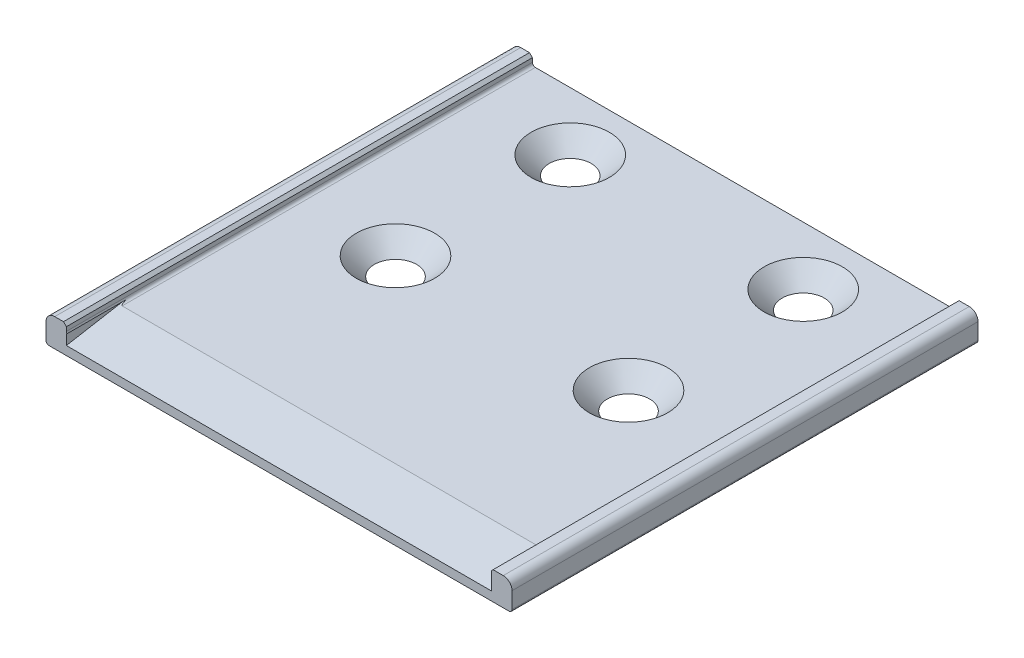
SolidWorks part; units mm, degrees
ref_plane "Front Plane" through (0, 0, 0) normal (0, 0, 1) x (1, 0, 0)
ref_plane "Top Plane" through (0, 0, 0) normal (0, 1, 0) x (1, 0, 0)
ref_plane "Right Plane" through (0, 0, 0) normal (1, 0, 0) x (0, 0, -1)
sketch "Sketch1" plane through (0, 0, 0) normal (0, 0, 1) x (1, 0, 0)
  line L0 (76.75, 4.8) -> (78.5, 4.8)
  line L1 (0.5, 0) -> (79.5, 0)
  line L2 (0, 0.5) -> (0, 3.3)
  line L3 (1.5, 4.8) -> (3, 4.8)
  line L4 (80, 0.5) -> (80, 3.3)
  line L6 (3.5, 4.3) -> (3.5, 3.6)
  line L7 (4, 3.1) -> (76, 3.1)
  line L8 (76.5, 4.55) -> (76.5, 3.6)
  line L9 (3, 4.8) -> (3.5, 4.3)
  line L10 (76.75, 4.8) -> (76.5, 4.55)
  arc A0 (78.5, 4.8) -> (80, 3.3) centre (78.5, 3.3) cw
  arc A1 (0, 3.3) -> (1.5, 4.8) centre (1.5, 3.3) cw
  arc A2 (79.5, 0) -> (80, 0.5) centre (79.5, 0.5) ccw
  arc A3 (0, 0.5) -> (0.5, 0) centre (0.5, 0.5) ccw
  arc A4 (76.5, 3.6) -> (76, 3.1) centre (76, 3.6) cw
  arc A5 (3.5, 3.6) -> (4, 3.1) centre (4, 3.6) ccw
  point P9 (3.5, 4.8)
  point P10 (76.5, 4.8)
  point P14 (0, 4.8)
  point P20 (80, 0)
  point P23 (0, 0)
  dimension "D6" = 1.5
  dimension "D2" = 0.5
  dimension "D7" = 0.5
  dimension "D1" = 80
  dimension "D3" = 3.5
  dimension "D4" = 4.8
  dimension "D5" = 3.1
  dimension "D10" = 73
extrude "Boss-Extrude1" add sketch "Sketch1" against normal blind 80
sketch "Sketch2" plane through (0, 0, 0) normal (0, 0, 1) x (1, 0, 0)
  line L0 (0.5, 0) -> (79.5, 0) construction
  line L1 (16, 0) -> (24, 0)
  line L2 (16, 0) -> (16, -2.75)
  line L3 (16.25, -3) -> (23.75, -3)
  line L4 (24, 0) -> (24, -2.75)
  line L5 (20, -3) -> (20, 4.8258) construction
  line L6 (0, 3.3) -> (0, 0.5) construction
  line L7 (16, -2.75) -> (16.25, -3)
  line L8 (23.75, -3) -> (24, -2.75)
  line L9 (80, 0.5) -> (80, 3.3) construction
  line L10 (78.5, 4.8) -> (76.75, 4.8) construction
  point P1 (24, -3)
  point P2 (16, -3)
  dimension "D1" = 3
  dimension "D2" = 8
  dimension "D3" = 4
  dimension "D4" = 20
extrude "Boss-Extrude2" [suppressed] add sketch "Sketch2" against normal through all
hole_wizard "CSK for M6 Hex Socket Countersunk Cap Screw1" positions "Sketch3" profile "Sketch4" countersink size "M6" standard "ISO"
sketch "Sketch3" plane through (0, 3.1, 0) normal (0, 1, 0) x (1, 0, 0)
  line L0 (0, 80) -> (0, 0) construction
  line L2 (76, 0) -> (4, 0) construction
  point P0 (20, 40)
  point P10 (20, 70)
  point P11 (0, 0)
  point P12 (60, 40)
  point P13 (60, 70)
  point P14 (0, 0)
  point P15 (0, 0)
  dimension "D1" = 20
  dimension "D2" = 40
  dimension "D3" = 30
  dimension "D4" = 40
sketch "Sketch4" plane through (20, 3.1, -40) normal (1, 0, 0) x (0, 0, 1)
  line L0 (0, 0) -> (0, 39.9828)
  line L1 (0, 39.9828) -> (3.3, 38)
  line L2 (3.3, 38) -> (3.3, 3.42)
  line L3 (3.3, 3.42) -> (6.72, 0)
  line L5 (6.72, 0) -> (0, 0)
  line L6 (-3.3, 3.42) -> (-6.72, 0) construction
  line L10 (0, 39.9828) -> (-3.3, 38) construction
  line L11 (0, -6.35) -> (0, 107.95) construction
  dimension "Hole Dia." = 6.6
  dimension "Hole Depth" = 38
  dimension "Near C'Sink Dia." = 13.44
  dimension "Near C'Sink Angle" = 90
  dimension "Drill Angle" = 118
pattern_linear "LPattern1" [suppressed] count 2 spacing 30
ref_plane "Plane1" through (40, 0, 0) normal (1, 0, 0) x (0, 0, -1)
sketch "Sketch5" plane through (40, 0, 0) normal (1, 0, 0) x (0, 0, -1)
  line L0 (0, 1.5) -> (10.2083, 3.3)
  line L1 (0, 0.5) -> (0, 3.3) construction
  line L2 (10.2083, 3.3) -> (-0.7961, 3.3)
  line L3 (-0.7961, 3.3) -> (-0.7961, 1.5)
  line L4 (-0.7961, 1.5) -> (0, 1.5)
  dimension "D1" = 1.5
  dimension "D2" = 10
  dimension "D3" = 1.8
extrude "Cut-Extrude1" cut sketch "Sketch5" against normal mid plane 73
